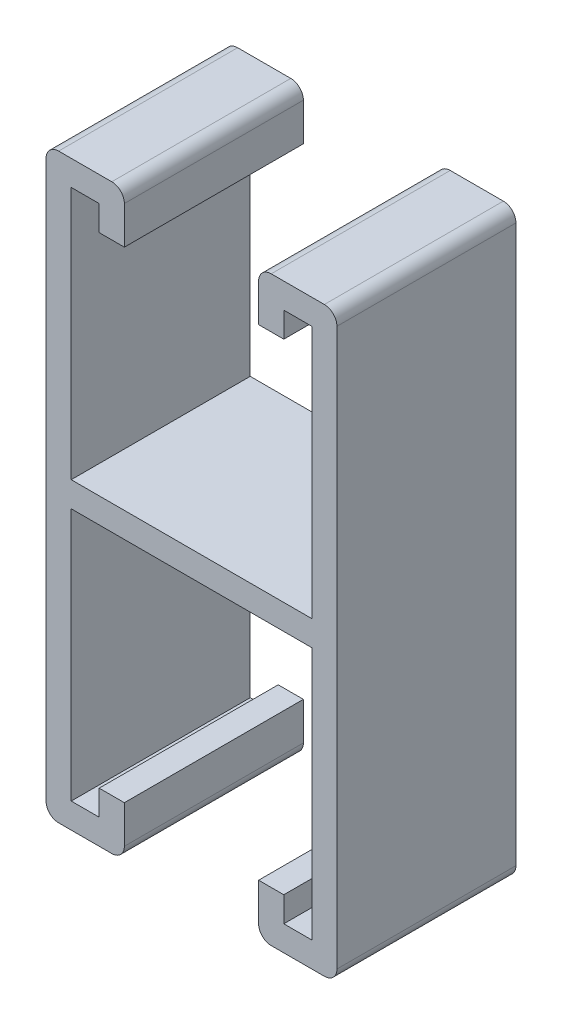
SolidWorks part; units mm, degrees
ref_plane "Plane1" through (0, 0, 0) normal (0, 0, 1) x (1, 0, 0)
ref_plane "Plane2" through (0, 0, 0) normal (0, 1, 0) x (1, 0, 0)
ref_plane "Plane3" through (0, 0, 0) normal (1, 0, 0) x (0, 0, -1)
sketch "Sketch1" plane through (0, 0, 0) normal (0, 0, 1) x (1, 0, 0)
  line L0 (-11.3109, 41.275) -> (-18.8516, 41.275)
  line L1 (-20.6375, 39.4891) -> (-20.6375, -39.4891)
  line L2 (25.727, 0) -> (-25.0678, 0) construction
  line L3 (20.6375, -39.4891) -> (20.6375, 39.4891)
  line L4 (18.8516, 41.275) -> (11.3109, 41.275)
  line L5 (9.525, 39.4891) -> (9.525, 34.1313)
  line L6 (-9.525, 39.4891) -> (-9.525, 34.1313)
  line L7 (-13.0969, 37.7031) -> (-13.0969, 34.1313)
  line L8 (-13.0969, 37.7031) -> (-17.0656, 37.7031)
  line L9 (-17.0656, 37.7031) -> (-17.0656, 1.7859)
  line L10 (-17.0656, 1.7859) -> (17.0656, 1.7859)
  line L11 (17.0656, 1.7859) -> (17.0656, 37.7031)
  line L12 (17.0656, 37.7031) -> (13.0969, 37.7031)
  line L13 (13.0969, 37.7031) -> (13.0969, 34.1313)
  line L14 (-13.0969, 34.1313) -> (-9.525, 34.1313)
  line L15 (9.525, 34.1313) -> (13.0969, 34.1313)
  line L16 (-11.3109, -41.275) -> (-18.8516, -41.275)
  line L17 (-13.0969, -37.7031) -> (-17.0656, -37.7031)
  line L18 (-13.0969, -37.7031) -> (-13.0969, -34.1313)
  line L19 (-9.525, -39.4891) -> (-9.525, -34.1313)
  line L20 (-13.0969, -34.1313) -> (-9.525, -34.1313)
  line L21 (18.8516, -41.275) -> (11.3109, -41.275)
  line L22 (9.525, -39.4891) -> (9.525, -34.1313)
  line L23 (9.525, -34.1313) -> (13.0969, -34.1313)
  line L24 (13.0969, -37.7031) -> (13.0969, -34.1313)
  line L25 (17.0656, -37.7031) -> (13.0969, -37.7031)
  line L26 (17.0656, -1.7859) -> (17.0656, -37.7031)
  line L27 (-17.0656, -37.7031) -> (-17.0656, -1.7859)
  line L28 (-17.0656, -1.7859) -> (17.0656, -1.7859)
  arc A0 (-11.3109, 41.275) -> (-9.525, 39.4891) centre (-11.3109, 39.4891) cw
  arc A1 (-20.6375, 39.4891) -> (-18.8516, 41.275) centre (-18.8516, 39.4891) cw
  arc A2 (-11.3109, -41.275) -> (-9.525, -39.4891) centre (-11.3109, -39.4891) ccw
  arc A3 (-20.6375, -39.4891) -> (-18.8516, -41.275) centre (-18.8516, -39.4891) ccw
  arc A4 (18.8516, 41.275) -> (20.6375, 39.4891) centre (18.8516, 39.4891) cw
  arc A5 (9.525, 39.4891) -> (11.3109, 41.275) centre (11.3109, 39.4891) cw
  arc A6 (18.8516, -41.275) -> (20.6375, -39.4891) centre (18.8516, -39.4891) ccw
  arc A7 (9.525, -39.4891) -> (11.3109, -41.275) centre (11.3109, -39.4891) ccw
  dimension "D2" = 1.7859
  dimension "D3" = 20.6375
  dimension "D4" = 41.275
  dimension "Width" = 41.275
  dimension "Height" = 82.55
  dimension "edge" = 11.1125
  dimension "D8" = 19.05
  dimension "ToeHt" = 7.1437
  dimension "D1" = 3.5719
  dimension "gauge" = 3.5719
extrude "Base-Extrude" add sketch "Sketch1" along normal mid plane 25.4
equation "\"D3@Sketch1\" = \"Width@Sketch1\" / 2"
equation "\"D2@Sketch1\" = \"gauge@Sketch1\" / 2"
equation "\"D8@Sketch1\" = \"Width@Sketch1\" - 2 * \"edge@Sketch1\""
equation "\"gauge@Sketch1\" = \"ToeHt@Sketch1\" / 2"
equation "\"D4@Sketch1\" = \"Height@Sketch1\" / 2"
